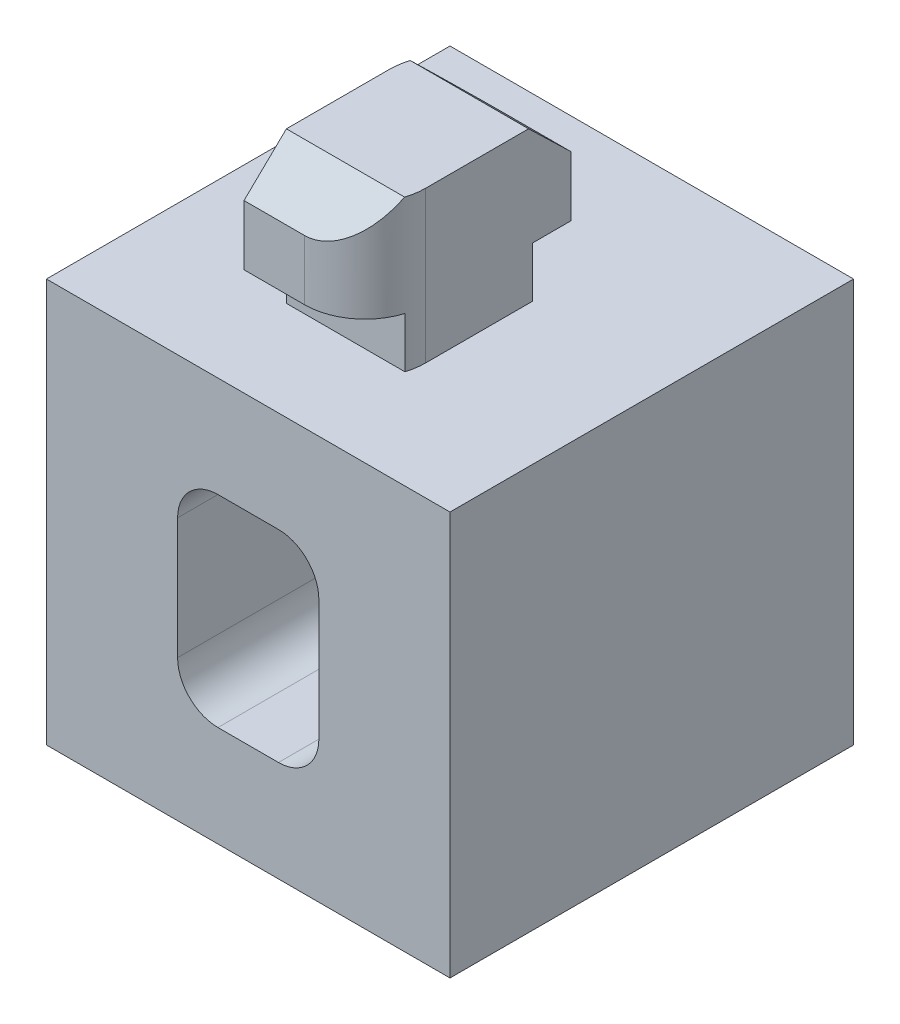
SolidWorks part; units mm, degrees
ref_plane "正面" through (0, 0, 0) normal (0, 0, 1) x (1, 0, 0)
ref_plane "平面" through (0, 0, 0) normal (0, 1, 0) x (1, 0, 0)
ref_plane "右側面" through (0, 0, 0) normal (1, 0, 0) x (0, 0, -1)
sketch "ｽｹｯﾁ1" plane through (0, 0, 0) normal (0, 0, 1) x (1, 0, 0)
  line L19 (-1.5, 5) -> (1.5, 5)
  line L20 (10, 10) -> (-10, 10)
  line L21 (-1.5, -5) -> (1.5, -5)
  line L22 (-10, -10) -> (10, -10)
  line L23 (-10, 10) -> (-10, -10)
  line L24 (-3.5, -3) -> (-3.5, 3)
  line L25 (10, -10) -> (10, 10)
  line L26 (3.5, -3) -> (3.5, 3)
  arc A8 (-1.5, 5) -> (-3.5, 3) centre (-1.5, 3) ccw
  arc A9 (-3.5, -3) -> (-1.5, -5) centre (-1.5, -3) ccw
  arc A10 (3.5, 3) -> (1.5, 5) centre (1.5, 3) ccw
  arc A11 (1.5, -5) -> (3.5, -3) centre (1.5, -3) ccw
  dimension "D1" = 10
  dimension "D2" = 10
  dimension "D3" = 10
  dimension "D4" = 7
extrude "押し出し1" add sketch "ｽｹｯﾁ1" along normal mid plane 20
sketch "ｽｹｯﾁ4" plane through (0, 0, 0) normal (1, 0, 0) x (0, 0, -1)
  line L0 (-5.1, 10) -> (1.1, 10)
  line L1 (-10, 10) -> (10, 10) construction
  line L11 (-5.1081, 17.5) -> (-7.2081, 15.4721)
  line L12 (0.8919, 17.5) -> (2.9919, 15.4721)
  line L13 (-7.2081, 12.5) -> (-7.2081, 15.4721)
  line L14 (2.9919, 12.5) -> (2.9919, 15.4721)
  line L15 (-5.1081, 17.5) -> (0.8919, 17.5)
  line L16 (1.1, 12.5) -> (1.1, 10)
  line L17 (-5.1, 12.5) -> (-5.1, 10)
  line L18 (1.1, 12.5) -> (2.9919, 12.5)
  line L19 (-7.2081, 12.5) -> (-5.1, 12.5)
  line L20 (-2, -12.0794) -> (-2, 19.396) construction
  dimension "D1" = 8
  dimension "D2" = 6
  dimension "D3" = 10.2
  dimension "D4" = 134
  dimension "D5" = 134
  dimension "D6" = 0
  dimension "D7" = 7.5
  dimension "D8" = 90
  dimension "D9" = 90
  dimension "D10" = 6.2
  dimension "D11" = 3.1
  dimension "D12" = 3.1
  dimension "D13" = 2.5
extrude "押し出し2" add sketch "ｽｹｯﾁ4" along normal mid plane 6
sketch "ｽｹｯﾁ6" plane through (0, 0, 0) normal (0, 0, 1) x (1, 0, 0)
  line L0 (-5.15, -10) -> (-5.15, -8.5)
  line L1 (-10, -10) -> (10, -10) construction
  line L2 (-5.15, 7) -> (5.15, 7)
  line L3 (5.15, 7) -> (5.15, -7.5)
  line L4 (5.15, -10) -> (-5.15, -10)
  line L5 (-5.15, -7.5) -> (-5.15, 7)
  line L6 (5.15, -8.5) -> (5.15, -10)
  arc A0 (-5.15, -7.5) -> (-5.15, -8.5) centre (-5.4167, -8) cw
  arc A1 (5.15, -7.5) -> (5.15, -8.5) centre (5.4167, -8) ccw
  dimension "D1" = 10.3
  dimension "D2" = 17
  dimension "D3" = 5.15
extrude "ｶｯﾄ - 押し出し1" cut sketch "ｽｹｯﾁ6" against normal mid plane 5.4
fillet "ﾌｨﾚｯﾄ2" radius 3 2 edges at (3, 13.986, 7.2081) (-3, 13.986, -2.9919)
